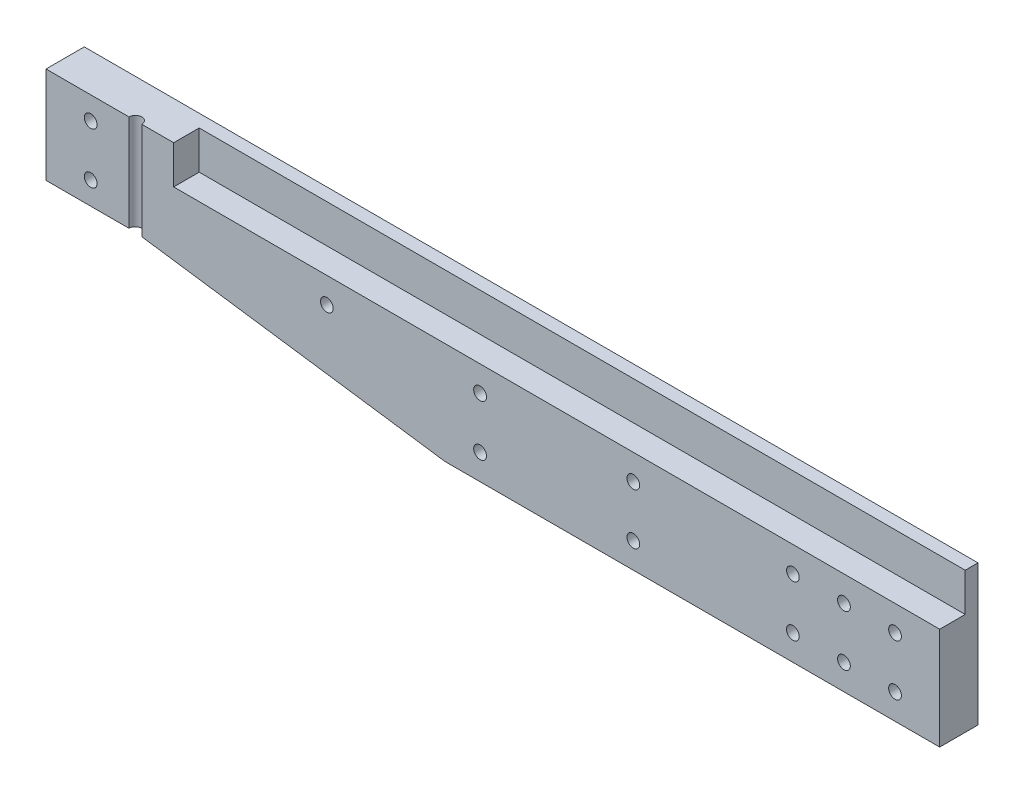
SolidWorks part; units mm, degrees
ref_plane "Front Plane" through (0, 0, 0) normal (0, 0, 1) x (1, 0, 0)
ref_plane "Top Plane" through (0, 0, 0) normal (0, 1, 0) x (1, 0, 0)
ref_plane "Right Plane" through (0, 0, 0) normal (1, 0, 0) x (0, 0, -1)
sketch "Sketch1" plane through (0, 0, 0) normal (0, 1, 0) x (1, 0, 0)
  line L0 (-25.4, 2.54) -> (-111.125, 2.54)
  line L1 (0, 0) -> (-25.4, 0)
  line L2 (0, 0) -> (0, 19.05)
  line L3 (0, 19.05) -> (-25.4, 19.05)
  line L4 (-25.4, 0) -> (-25.4, 2.54)
  line L5 (-111.125, 2.54) -> (-111.125, 0)
  line L6 (-111.125, 0) -> (-492.125, 0)
  line L7 (-25.4, 19.05) -> (-492.125, 19.05)
  line L8 (-492.125, 19.05) -> (-492.125, 0)
  line L9 (-111.125, 0) -> (-25.4, 0)
  dimension "D1" = 19.05
  dimension "D2" = 25.4
  dimension "D3" = 85.725
  dimension "D4" = 381
  dimension "D5" = 2.54
extrude "Boss-Extrude1" add sketch "Sketch1" along normal blind 69.85 contours L7 L8 L6 L5 L0 L4 | L4 L1 L2 L3 | L5 L9 L4 L0
sketch "Sketch2" plane through (0, 0, 0) normal (0, 0, 1) x (1, 0, 0)
  line L0 (-492.125, 34.925) -> (-246.0625, 0)
  line L2 (-492.125, 69.85) -> (-492.125, 0) construction
  line L4 (0, 0) -> (-492.125, 0) construction
extrude "Cut-Extrude1" cut sketch "Sketch2" against normal through all and the other way through all flip side to cut
sketch "Sketch3" plane through (0, 0, 0) normal (1, 0, 0) x (0, 0, -1)
  line L0 (6.35, 69.85) -> (6.35, 50.8)
  line L1 (19.05, 50.8) -> (19.05, 69.85)
  line L2 (19.05, 50.8) -> (6.35, 50.8)
  line L3 (19.05, 69.85) -> (6.35, 69.85)
extrude "Cut-Extrude2" cut sketch "Sketch3" against normal blind 381
sketch "Sketch4" plane through (0, 69.85, 0) normal (0, 1, 0) x (-1, 0, 0)
  line L1 (0, 0) -> (492.125, 0) construction
  line L2 (400.05, 0) -> (400.05, -19.05)
  dimension "D1" = 19.05
  dimension "D2" = 92.075
extrude "Cut-Extrude3" cut sketch "Sketch4" against normal through all and the other way through all
sketch "Sketch5" plane through (-400.05, 0, 0) normal (-1, 0, 0) x (0, 0, 1)
  line L1 (0, 21.8563) -> (-19.05, 21.8563)
  line L2 (0, 21.8563) -> (0, 69.85)
  line L3 (0, 69.85) -> (-19.05, 69.85)
  line L4 (-19.05, 21.8563) -> (-19.05, 69.85)
extrude "Boss-Extrude2" add sketch "Sketch5" along normal blind 44.45
sketch "Sketch7" plane through (0, 0, -19.05) normal (0, 0, -1) x (-1, 0, 0)
  line L0 (400.05, 21.8563) -> (400.05, 69.85)
  line L1 (381, 69.85) -> (444.5, 69.85) construction
sketch "Sketch8" plane through (0, 69.85, 0) normal (0, 1, 0) x (1, 0, 0)
  circle A0 centre (-400.05, 19.05) radius 3.175
  dimension "D1" = 6.35
extrude "Cut-Extrude5" cut sketch "Sketch8" against normal up to next
sketch "Sketch9" plane through (0, 0, 0) normal (0, 0, 1) x (1, 0, 0)
  line L0 (-47.625, 50.8) -> (-47.625, 0)
  line L1 (0, 0) -> (-95.25, 0)
  line L2 (0, 0) -> (0, 50.8)
  line L3 (0, 50.8) -> (-95.25, 50.8)
  line L4 (-95.25, 0) -> (-95.25, 50.8)
  line L5 (-73.025, 25.4) -> (-73.025, 38.1)
  line L6 (-47.625, 25.4) -> (-47.625, 38.1)
  line L7 (-47.625, 25.4) -> (-47.625, 12.7)
  line L8 (-47.625, 25.4) -> (-73.025, 25.4)
  line L9 (-47.625, 25.4) -> (-22.225, 25.4)
  line L10 (-73.025, 25.4) -> (-73.025, 12.7)
  line L11 (-22.225, 25.4) -> (-22.225, 38.1)
  line L12 (-22.225, 25.4) -> (-22.225, 12.7)
  line L13 (-95.25, 25.4) -> (-152.4, 25.4)
  line L14 (-152.4, 25.4) -> (-152.4, 38.1)
  line L15 (-152.4, 25.4) -> (-152.4, 12.7)
  line L16 (-152.4, 25.4) -> (-228.6, 25.4)
  line L17 (-228.6, 25.4) -> (-228.6, 38.1)
  line L18 (-228.6, 25.4) -> (-228.6, 12.7)
  line L19 (-228.6, 38.1) -> (-304.8, 38.1)
  circle A0 centre (-47.625, 38.1) radius 3.175
  circle A1 centre (-47.625, 12.7) radius 3.175
  circle A2 centre (-73.025, 38.1) radius 3.1496
  circle A3 centre (-73.025, 12.7) radius 3.175
  circle A4 centre (-22.225, 38.1) radius 3.175
  circle A5 centre (-22.225, 12.7) radius 3.175
  circle A6 centre (-152.4, 38.1) radius 3.175
  circle A7 centre (-152.4, 12.7) radius 3.175
  circle A8 centre (-228.6, 38.1) radius 3.175
  circle A9 centre (-228.6, 12.7) radius 3.175
  circle A10 centre (-304.8, 38.1) radius 3.175
  dimension "D3" = 25.4
  dimension "D5" = 12.7
  dimension "D7" = 6.35
  dimension "D8" = 6.35
  dimension "D11" = 6.2992
  dimension "D12" = 6.35
  dimension "D14" = 6.35
  dimension "D15" = 6.35
  dimension "D21" = 6.35
  dimension "D22" = 6.35
  dimension "D25" = 12.7
  dimension "D27" = 6.35
  dimension "D28" = 6.35
  dimension "D30" = 6.35
  dimension "D1" = 95.25
  dimension "D2" = 50.8
  dimension "D4" = 25.4
  dimension "D6" = 12.7
  dimension "D9" = 12.7
  dimension "D10" = 12.7
  dimension "D13" = 12.7
  dimension "D16" = 12.7
  dimension "D17" = 12.7
  dimension "D18" = 12.7
  dimension "D19" = 57.15
  dimension "D20" = 90
  dimension "D23" = 12.7
  dimension "D24" = 12.7
  dimension "D26" = 12.7
  dimension "D29" = 76.2
  dimension "D31" = 76.2
extrude "Cut-Extrude6" cut sketch "Sketch9" against normal up to next
mirror "Mirror1" about plane through (-629.274, 69.85, -19.05) normal (0, 0, 1) of "Cut-Extrude1", "Boss-Extrude1", "Cut-Extrude2", "Boss-Extrude2", "Cut-Extrude5", "Cut-Extrude6"
sketch "Sketch10" plane through (0, 69.85, 0) normal (0, 1, 0) x (-1, 0, 0)
  line L0 (444.5, -19.05) -> (-125.8301, -19.05)
extrude "Cut-Extrude7" cut sketch "Sketch10" against normal through all and the other way through all flip side to cut
sketch "Sketch11" plane through (0, 0, -19.05) normal (0, 0, 1) x (1, 0, 0)
  line L0 (-444.5, 28.1653) -> (-444.5, 69.85)
  line L1 (-403.225, 69.85) -> (-492.125, 69.85) construction
extrude "Cut-Extrude8" cut sketch "Sketch11" against normal through all and the other way through all
sketch "Sketch12" plane through (0, 0, -38.1) normal (0, 0, -1) x (-1, 0, 0)
  line L0 (400.05, 45.8531) -> (444.5, 45.8531)
  line L1 (400.05, 21.8563) -> (444.5, 21.8563)
  line L2 (400.05, 21.8563) -> (400.05, 69.85)
  line L3 (400.05, 69.85) -> (444.5, 69.85)
  line L4 (444.5, 21.8563) -> (444.5, 69.85)
  line L6 (422.275, 45.8531) -> (422.275, 58.5531)
  line L7 (422.275, 45.8531) -> (422.275, 33.1531)
  circle A0 centre (422.275, 58.5531) radius 3.175
  circle A1 centre (422.275, 33.1531) radius 3.175
  dimension "D1" = 6.35
  dimension "D2" = 6.35
  dimension "D3" = 12.7
  dimension "D4" = 12.7
  dimension "D5" = 90
  dimension "D6" = 90
extrude "Cut-Extrude9" cut sketch "Sketch12" against normal up to next
